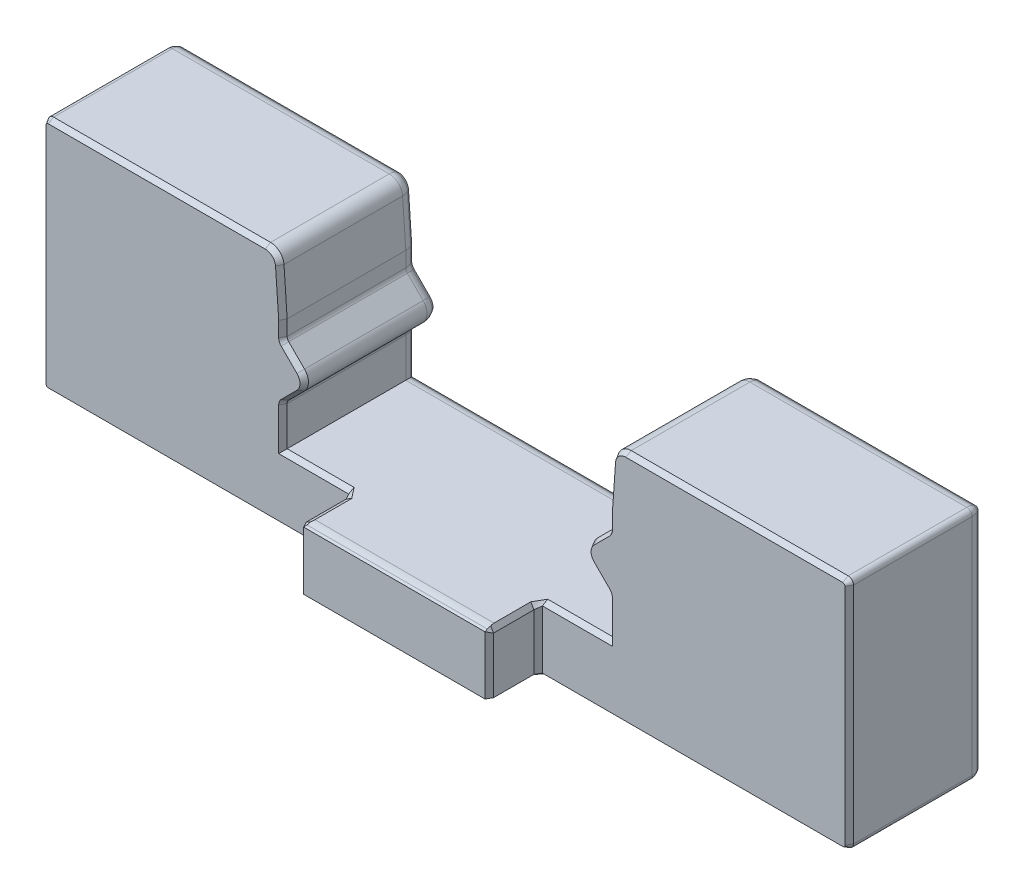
SolidWorks part; units mm, degrees
ref_plane "Front Plane" through (0, 0, 0) normal (0, 0, 1) x (1, 0, 0)
ref_plane "Top Plane" through (0, 0, 0) normal (0, 1, 0) x (1, 0, 0)
ref_plane "Right Plane" through (0, 0, 0) normal (1, 0, 0) x (0, 0, -1)
sketch "Sketch1" plane through (0, 0, 0) normal (0, 0, 1) x (1, 0, 0)
  line L0 (0, 0) -> (30, 0)
  line L1 (30, 0) -> (30, 8.75)
  line L2 (30, 8.75) -> (21.1, 8.75)
  line L3 (21.1, 8.75) -> (21.1, 5.94)
  line L4 (21.1, 5.94) -> (20.1, 4.94)
  line L6 (21.1, 3.94) -> (21.1, 2.4)
  line L7 (21.1, 2.4) -> (8.9, 2.4)
  line L8 (8.9, 2.4) -> (8.9, 3.94)
  line L9 (8.9, 3.94) -> (9.9, 4.94)
  line L11 (8.9, 5.94) -> (8.9, 8.75)
  line L12 (8.9, 8.75) -> (0, 8.75)
  line L13 (0, 8.75) -> (0, 0)
  line L14 (-4.1731, 4.94) -> (35.0238, 4.94) construction
  line L15 (-4.1731, 5.94) -> (35.0238, 5.94) construction
  line L16 (35.0238, 3.94) -> (-4.1731, 3.94) construction
  line L17 (8.9, 5.94) -> (9.9, 4.94)
  line L18 (20.1, 4.94) -> (21.1, 3.94)
  point P4 (15, 2.4)
  point P16 (15, 0)
  dimension "D1" = 30
  dimension "D2" = 2.4
  dimension "D3" = 6.35
  dimension "D4" = 12.2
  dimension "D5" = 2.54
  dimension "D6" = 1
  dimension "D7" = 1
  dimension "D8" = 1
extrude "Boss-Extrude1" add sketch "Sketch1" along normal blind 6.858
sketch "Sketch4" plane through (0, 0, 6.858) normal (0, 0, 1) x (1, 0, 0)
  line L0 (0, 0) -> (30, 0) construction
  line L1 (-1.8514, 10.7491) -> (32.2196, 10.7491)
  line L2 (-1.8514, 10.7491) -> (-1.8514, -3.0161)
  line L3 (-1.8514, -3.0161) -> (32.2196, -3.0161)
  line L4 (32.2196, 10.7491) -> (32.2196, -3.0161)
  line L5 (11.5075, 2.9985) -> (18.4925, 2.9985)
  line L6 (11.5075, 2.9985) -> (11.5075, -0.7716)
  line L7 (11.5075, -0.7716) -> (18.4925, -0.7716)
  line L8 (18.4925, 2.9985) -> (18.4925, -0.7716)
  point P10 (15, -0.7716)
  point P11 (15, 0)
  dimension "D1" = 6.985
extrude "Cut-Extrude3" cut sketch "Sketch4" against normal blind 1.905
fillet "Fillet1" radius 0.2 8 edges at (21.1, 5.94, 2.4765) (21.1, 3.94, 2.4765) (8.9, 3.94, 2.4765) (8.9, 5.94, 2.4765) (30, 0, 2.4765) (0, 0, 2.4765) (30, 8.75, 2.4765) (0, 8.75, 2.4765)
chamfer "Chamfer1" distance 2.159 angle 4 2 edges at (21.1, 8.75, 2.4765) (8.9, 8.75, 2.4765)
fillet "Fillet2" radius 0.5 2 edges at (20.1, 4.94, 2.4765) (9.9, 4.94, 2.4765)
fillet "Fillet3" radius 0.5 2 edges at (21.251, 8.75, 2.4765) (8.749, 8.75, 2.4765)
chamfer "Chamfer2" distance 0.2 angle 30 68 edges at (21.1, 6.3069, 0) (21.0848, 5.9463, 0) (20.7475, 5.5875, 0) (20.3071, 4.94, 0) (20.7475, 4.2925, 0) (21.0848, 3.9337, 0) (21.1, 3.1286, 0) (15, 2.4, 0) (8.9, 3.1286, 0) (8.9152, 3.9337, 0) (9.2525, 4.2925, 0) (9.6929, 4.94, 0) (9.2525, 5.5875, 0) (8.9152, 5.9463, 0) (8.9, 6.3069, 0) (8.8408, 7.4379, 0) (8.6238, 8.6157, 0) (4.2414, 8.75, 0) (0.0586, 8.6914, 0) (0, 4.375, 0) (0.0586, 0.0586, 0) (15, 0, 0) (29.9414, 0.0586, 0) (30, 4.375, 0) (29.9414, 8.6914, 0) (25.7586, 8.75, 0) (21.3762, 8.6157, 0) (21.1592, 7.4379, 0) (15, 0, 6.858) (15, 2.4, 6.858) (18.4925, 1.2, 6.858) (11.5075, 1.2, 6.858) (18.4925, 0, 5.9055) (18.4925, 2.4, 5.9055) (29.9414, 8.6914, 4.953) (30, 4.375, 4.953) (29.9414, 0.0586, 4.953) (24.1463, 0, 4.953) (18.4925, 1.2, 4.953) (19.7963, 2.4, 4.953) (21.1, 3.1286, 4.953) (21.0848, 3.9337, 4.953) (20.7475, 4.2925, 4.953) (20.3071, 4.94, 4.953) (20.7475, 5.5875, 4.953) (21.0848, 5.9463, 4.953) (21.1, 6.3069, 4.953) (21.1592, 7.4379, 4.953) (21.3762, 8.6157, 4.953) (25.7586, 8.75, 4.953) (11.5075, 2.4, 5.9055) (11.5075, 0, 5.9055) (8.9, 6.3069, 4.953) (8.9152, 5.9463, 4.953) (9.2525, 5.5875, 4.953) (9.6929, 4.94, 4.953) (9.2525, 4.2925, 4.953) (8.9152, 3.9337, 4.953) (8.9, 3.1286, 4.953) (10.2038, 2.4, 4.953) (11.5075, 1.2, 4.953) (5.8537, 0, 4.953) (0.0586, 0.0586, 4.953) (0, 4.375, 4.953) (0.0586, 8.6914, 4.953) (4.2414, 8.75, 4.953) (8.6238, 8.6157, 4.953) (8.8408, 7.4379, 4.953)
fillet "Fillet4" radius 0.5 29 edges at (21.1, 6.3069, 0.2) (21.0848, 5.9463, 0.2) (20.7475, 5.5875, 0.2) (20.3071, 4.94, 0.2) (20.7475, 4.2925, 0.2) (21.0848, 3.9337, 0.2) (8.9, 6.3069, 0.2) (8.9152, 5.9463, 0.2) (9.2525, 5.5875, 0.2) (9.6929, 4.94, 0.2) (9.2525, 4.2925, 0.2) (8.9152, 3.9337, 0.2) (8.8408, 7.4379, 0.2) (8.6238, 8.6157, 0.2) (4.2414, 8.75, 0.2) (0.0586, 8.6914, 0.2) (21.1592, 7.4379, 0.2) (21.3762, 8.6157, 0.2) (25.7586, 8.75, 0.2) (29.9414, 8.6914, 0.2) (30, 4.375, 0.2) (29.9414, 0.0586, 0.2) (15, 0, 0.2) (0.0586, 0.0586, 0.2) (15, 2.4, 0.2) (15.0423, 2.4, 6.658) (21.1, 3.1286, 0.2) (8.9, 3.1286, 0.2) (0, 4.375, 0.2)
